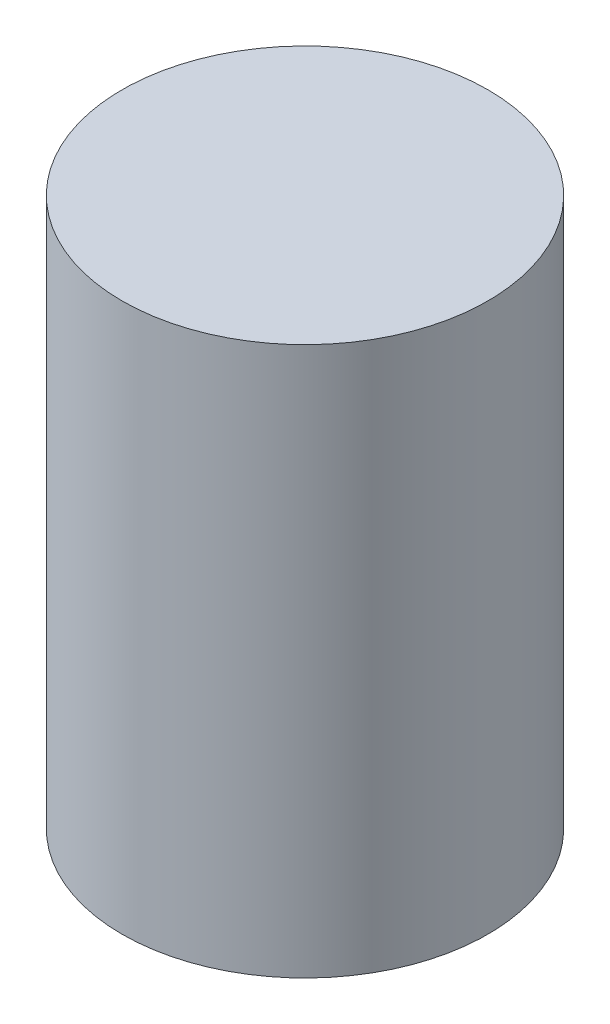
SolidWorks part; units mm, degrees
ref_plane "Front Plane" through (0, 0, 0) normal (0, 0, 1) x (1, 0, 0)
ref_plane "Top Plane" through (0, 0, 0) normal (0, 1, 0) x (1, 0, 0)
ref_plane "Right Plane" through (0, 0, 0) normal (1, 0, 0) x (0, 0, -1)
sketch "Sketch1"
extrude "Extrude1" add sketch "Sketch1" along normal blind 152.4
